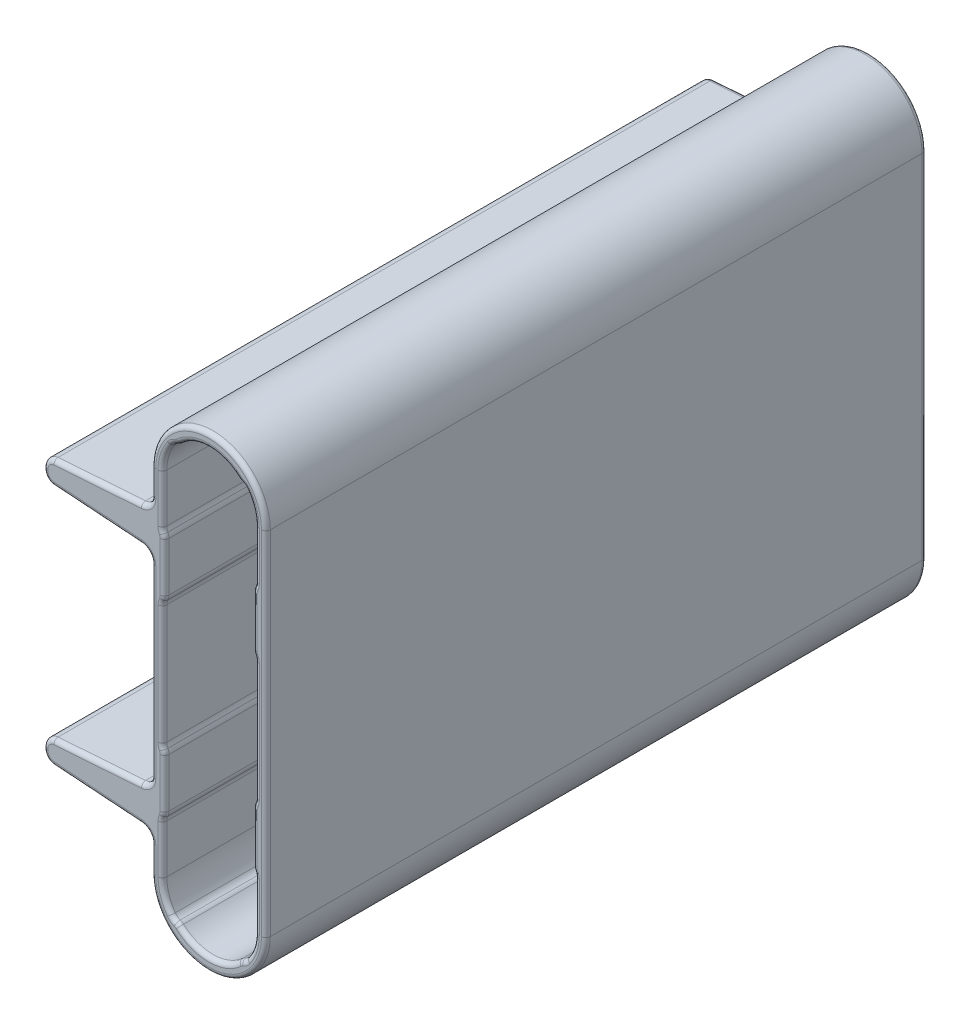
SolidWorks part; units mm, degrees
ref_plane "Front Plane" through (0, 0, 0) normal (0, 0, 1) x (1, 0, 0)
ref_plane "Top Plane" through (0, 0, 0) normal (0, 1, 0) x (1, 0, 0)
ref_plane "Right Plane" through (0, 0, 0) normal (1, 0, 0) x (0, 0, -1)
sketch "Sketch1" plane through (0, 0, 0) normal (0, 0, 1) x (1, 0, 0)
  line L0 (0, 0) -> (126.5517, 0) construction
  line L1 (0, 0) -> (65.9983, -75.128) construction
  line L2 (0, 0) -> (65.9983, 75.128) construction
  line L3 (0, 0) -> (100, 0) construction
  line L4 (0, 0) -> (0, -117.3978) construction
  line L5 (0, 80) -> (0, -80) construction
  line L6 (20, 80) -> (20, -80)
  line L7 (-20, 80) -> (-20, -80)
  line L8 (133.8609, 17.5) -> (145, 17.5)
  line L9 (133.8609, -17.5) -> (145, -17.5)
  line L10 (145, 17.5) -> (145, -17.5)
  line L11 (135, 0) -> (145, -17.5) construction
  line L12 (135, 0) -> (145, 17.5) construction
  line L13 (-145, 17.5) -> (-133.8609, 17.5)
  line L14 (-145, 17.5) -> (-145, -17.5)
  line L15 (-145, -17.5) -> (-133.8609, -17.5)
  line L16 (-145, 17.5) -> (-135, 0) construction
  line L17 (-145, -17.5) -> (-135, 0) construction
  line L18 (21, 80) -> (21, -80)
  line L19 (-21, 80) -> (-21, -80)
  line L20 (26, 80) -> (26, -80)
  line L21 (-26, 80) -> (-26, -80)
  line L22 (14.1421, -94.1421) -> (14.8492, -94.8492)
  line L23 (-14.1421, -94.1421) -> (-14.8492, -94.8492)
  line L24 (-14.1421, 94.1421) -> (-14.8492, 94.8492)
  line L25 (14.1421, 94.1421) -> (14.8492, 94.8492)
  line L26 (21, -55) -> (20, -55)
  line L27 (21, -30) -> (20, -30)
  line L28 (21, 30) -> (20, 30)
  line L29 (21, 55) -> (20, 55)
  line L30 (-21, -30) -> (-20, -30)
  line L31 (-21, -55) -> (-20, -55)
  line L32 (-21, 55) -> (-20, 55)
  line L33 (-21, 30) -> (-20, 30)
  line L34 (0, -80) -> (14.1421, -94.1421) construction
  line L35 (0, -80) -> (-14.1421, -94.1421) construction
  arc A0 (65.9983, -75.128) -> (65.9983, 75.128) centre (0, 0) ccw construction
  arc A1 (79.198, -90.1536) -> (79.198, 90.1536) centre (0, 0) ccw
  arc A2 (52.7987, -60.1024) -> (52.7987, 60.1024) centre (0, 0) ccw
  arc A3 (52.7987, -60.1024) -> (79.198, -90.1536) centre (65.9983, -75.128) ccw
  arc A4 (79.198, 90.1536) -> (52.7987, 60.1024) centre (65.9983, 75.128) ccw
  arc A5 (-65.9983, -75.128) -> (-65.9983, 75.128) centre (0, 0) cw construction
  arc A6 (-79.198, -90.1536) -> (-79.198, 90.1536) centre (0, 0) cw
  arc A7 (-52.7987, -60.1024) -> (-52.7987, 60.1024) centre (0, 0) cw
  arc A8 (-52.7987, -60.1024) -> (-79.198, -90.1536) centre (-65.9983, -75.128) cw
  arc A9 (48.8388, -55.5947) -> (83.1579, -94.6613) centre (65.9983, -75.128) ccw
  arc A10 (83.1579, -94.6613) -> (83.1579, 94.6613) centre (0, 0) ccw
  arc A11 (83.1579, 94.6613) -> (48.8388, 55.5947) centre (65.9983, 75.128) ccw
  arc A12 (48.8388, -55.5947) -> (48.8388, 55.5947) centre (0, 0) ccw
  arc A13 (52.1387, -59.3512) -> (79.858, -90.9049) centre (65.9983, -75.128) ccw
  arc A14 (52.1387, -59.3512) -> (52.1387, 59.3512) centre (0, 0) ccw
  arc A15 (79.858, 90.9049) -> (52.1387, 59.3512) centre (65.9983, 75.128) ccw
  arc A16 (79.858, -90.9049) -> (79.858, 90.9049) centre (0, 0) ccw
  arc A17 (-79.198, 90.1536) -> (-52.7987, 60.1024) centre (-65.9983, 75.128) cw
  arc A18 (20, 80) -> (-20, 80) centre (0, 80) ccw
  arc A19 (-20, -80) -> (20, -80) centre (0, -80) ccw
  circle A20 centre (65.9983, 75.128) radius 7.5
  circle A21 centre (65.9983, -75.128) radius 7.5
  circle A22 centre (0, -80) radius 7.5
  circle A23 centre (0, 80) radius 7.5
  circle A24 centre (-65.9983, 75.128) radius 7.5
  circle A25 centre (-65.9983, -75.128) radius 7.5
  circle A26 centre (0, 0) radius 135
  arc A27 (-21, -80) -> (21, -80) centre (0, -80) ccw
  arc A28 (21, 80) -> (-21, 80) centre (0, 80) ccw
  arc A29 (-26, -80) -> (26, -80) centre (0, -80) ccw
  arc A30 (26, 80) -> (-26, 80) centre (0, 80) ccw
  point P20 (100, 0)
  point P30 (-100, 0)
  point P37 (0, 0)
  point P55 (135, 0)
  point P59 (-135, 0)
  dimension "D1" = 79
  dimension "D2" = 42
  dimension "D5" = 1
  dimension "D3" = 5
  dimension "D4" = 48.701
  dimension "D7" = 25
  dimension "D8" = 30
  dimension "D6" = 5
extrude "Extrude1" add sketch "Sketch1" along normal blind 300 contours L20 A30 L21 A29 A28 L18 A27 L19 | L23 A27 L22 A19 | L19 L31 L7 L30 | L18 L27 L6 L26 | L19 L33 L7 L32 | L18 L29 L6 L28 | L25 A28 L24 A18
ref_plane "Plane4" through (-75, 0, 0) normal (1, 0, 0) x (0, 0, -1)
sketch "Sketch3" plane through (-75, 0, 0) normal (1, 0, 0) x (0, 0, -1)
  line L0 (17.1923, 0) -> (-312.4893, 0) construction
  line L2 (-300, 80) -> (-300, -80) construction
  line L3 (0, 80) -> (0, -80) construction
  line L4 (-300, -50) -> (0, -50)
  line L5 (-300, -50) -> (-300, -60)
  line L6 (-300, -60) -> (0, -60)
  line L7 (0, -50) -> (0, -60)
  dimension "D1" = 10
  dimension "D2" = 100
extrude "Extrude2" add sketch "Sketch3" along normal up to body
draft "Draft1" type of draft neutral plane draft angle 4 faces to draft 2 parameters "D1"=4
ref_plane "Plane3" through (75, 0, 0) normal (1, 0, 0) x (0, 0, -1)
mirror "Mirror1" about plane through (0, 0, 0) normal (0, 1, 0) of "Draft1", "Extrude2"
ref_plane "Plane1" through (0, 0, 50) normal (0, 0, 1) x (1, 0, 0)
sketch "Sketch4" plane through (0, 0, 50) normal (0, 0, 1) x (1, 0, 0)
  line L0 (4.6962, -45.5289) -> (4.6962, 45.5289) construction
  line L1 (-26, -19.975) -> (-26, 19.975)
  line L2 (4.6962, 0) -> (-35, 0) construction
  line L3 (-26, 46.5736) -> (-26, -46.5736) construction
  circle A1 centre (-35, 0) radius 3.75
  arc A2 (-35.5, 9.9875) -> (-35.5, -9.9875) centre (-35, 0) ccw
  arc A5 (-26, -19.975) -> (-35.5, -9.9875) centre (-36, -19.975) ccw
  arc A6 (-26, 19.975) -> (-35.5, 9.9875) centre (-36, 19.975) cw
  dimension "D2" = 7.5
  dimension "D3" = 20
  dimension "D4" = 10
  dimension "D1" = 9
extrude "Extrude3" add sketch "Sketch4" along normal blind 25
sketch "Sketch5" plane through (0, 0, 0) normal (1, 0, 0) x (0, 0, -1)
  line L0 (0, 0) -> (-40, 0) construction
  line L1 (-45, 40) -> (-40, 40)
  line L2 (-45, 40) -> (-45, -40)
  line L3 (-45, -40) -> (-40, -40)
  line L4 (-40, 40) -> (-40, -40)
  line L5 (0, 46.5736) -> (0, -46.5736) construction
  line L6 (-42.5, -40) -> (-42.5, 40) construction
  line L7 (-50, -9.9875) -> (-50, 9.9875) construction
  dimension "D1" = 5
  dimension "D2" = 5
  dimension "D3" = 80
extrude "Cut-Extrude2" cut sketch "Sketch5" against normal up to next contours L2 L3 L4 L1
pattern_linear "LPattern1" count 2 spacing 17.5 along (0, 0, -1) of "Cut-Extrude2"
fillet "Fillet9" radius 5 8 edges at (-75, 60, 150) (-75, 50, 150) (-26, 63.4264, 150) (-26, 46.5736, 150) (-75, -50, 150) (-75, -60, 150) (-26, -46.5736, 150) (-26, -63.4264, 150)
fillet "Fillet2" radius 5 16 edges at (-21, 30, 11.25) (-21, 30, 33.75) (-21, -30, 11.25) (-21, -30, 33.75) (-21, 30, 172.5) (-21, 55, 150) (-14.8492, 94.8492, 150) (14.8492, 94.8492, 150) (21, 55, 150) (21, 30, 150) (21, -30, 150) (21, -55, 150) (14.8492, -94.8492, 150) (-14.8492, -94.8492, 150) (-21, -30, 172.5) (-21, -55, 150)
fillet "Fillet3" radius 5 16 edges at (-14.1421, 94.1421, 150) (14.1421, 94.1421, 150) (20, 55, 150) (20, 30, 150) (20, -30, 150) (20, -55, 150) (14.1421, -94.1421, 150) (-14.1421, -94.1421, 150) (-20, -55, 150) (-20, -30, 172.5) (-20, -30, 33.75) (-20, -30, 11.25) (-20, 55, 150) (-20, 30, 11.25) (-20, 30, 33.75) (-20, 30, 172.5)
fillet "Fillet4" radius 2 120 edges at (26, 0, 300) (0, 106, 300) (-26, 74.0445, 300) (0, -106, 300) (-75, 55, 300) (-75, 55, 0) (-26, -74.0445, 0) (-50.5, -61.7132, 0) (-75, -55, 0) (-50.5, -48.2868, 0) (-26, 0, 0) (-50.5, 48.2868, 0) (-50.5, 61.7132, 0) (-73.6568, -58.7474, 0) (-73.6568, -51.2526, 0) (-73.6568, 51.2526, 0) (-73.6568, 58.7474, 0) (-50.5, 61.7132, 300) (-50.5, 48.2868, 300) (-26, 0, 300) (-50.5, -48.2868, 300) (-75, -55, 300) (-50.5, -61.7132, 300) (-26, -74.0445, 300) (-73.6568, -58.7474, 300) (-73.6568, -51.2526, 300) (-73.6568, 51.2526, 300) (-73.6568, 58.7474, 300) (-27.3432, 64.679, 0) (-27.3432, 64.679, 300) (-27.3432, 45.321, 300) (-27.3432, 45.321, 0) (-27.3432, -45.321, 300) (-27.3432, -45.321, 0) (-27.3432, -64.679, 0) (-27.3432, -64.679, 300) (-21, 0, 0) (-21, 0, 300) (-20.007, 86.3812, 0) (-20.007, 86.3812, 300) (21, 0, 0) (21, 0, 300) (21, -69, 0) (21, -69, 300) (20.007, -86.3812, 0) (20.007, -86.3812, 300) (-21, -69, 0) (-21, -69, 300) (-20.8734, -28.118, 0) (-20.8734, 28.118, 300) (-20.8734, 56.882, 0) (-16.1389, 93.192, 300) (16.1389, 93.192, 0) (20.8734, 56.882, 300) (20.8734, 28.118, 0) (20.8734, -28.118, 300) (20.8734, -56.882, 0) (0, -106, 0) (16.1389, -93.192, 300) (-16.1389, -93.192, 0) (-26, 74.0445, 0) (-20.8734, -56.882, 300) (0, 106, 0) (26, 0, 0) (-21, 69, 0) (0, 100, 0) (0, 100, 300) (-16.1389, 93.192, 0) (-20, 42.5, 0) (-20.8734, 28.118, 0) (-20, -42.5, 0) (-20.8734, -56.882, 0) (0, -100, 0) (16.1389, -93.192, 0) (20, -42.5, 0) (20.8734, -28.118, 0) (-20.007, -86.3812, 0) (20, 42.5, 0) (20.8734, 56.882, 0) (-20.1266, 30.2409, 0) (-20.1266, 54.7591, 0) (-20.1266, -30.2409, 0) (-20.1266, -54.7591, 0) (-14.1161, -94.3053, 0) (14.1161, -94.3053, 0) (20.1266, -54.7591, 0) (20.1266, -30.2409, 0) (20.1266, 30.2409, 0) (20.1266, 54.7591, 0) (14.1161, 94.3053, 0) (-14.1161, 94.3053, 0) (20, 42.5, 300) (20.8734, 28.118, 300) (20, -42.5, 300) (20.8734, -56.882, 300) (0, -100, 300) (-16.1389, -93.192, 300) (-20, -42.5, 300) (-20.8734, -28.118, 300) (-20, 42.5, 300) (-20.8734, 56.882, 300) (16.1389, 93.192, 300) (-20.1266, 30.2409, 300) (-20.1266, 54.7591, 300) (-20.1266, -30.2409, 300) (-20.1266, -54.7591, 300) (-14.1161, -94.3053, 300) (14.1161, -94.3053, 300) (20.1266, -54.7591, 300) (20.1266, -30.2409, 300) (20.1266, 30.2409, 300) (20.1266, 54.7591, 300) (14.1161, 94.3053, 300) (-14.1161, 94.3053, 300) (21, 69, 0) (20.007, 86.3812, 0) (20.007, 86.3812, 300) (-20.007, -86.3812, 300) (21, 69, 300) (-21, 69, 300)
fillet "Fillet5" radius 2.5 6 edges at (-28.7543, 13.083, 50) (-45, 0, 50) (-28.7543, 13.083, 75) (-45, 0, 75) (-28.7543, -13.083, 50) (-28.7543, -13.083, 75)
fillet "Fillet6" radius 2 6 edges at (-26, -15.5651, 74.4449) (-26, 15.5651, 74.4449) (-26, -15.5651, 50.5551) (-26, 15.5651, 50.5551) (-26, 0, 75) (-26, 0, 50)
ref_plane "Plane2" through (0, 0, 104) normal (0, 0, -1) x (-1, 0, 0)
sketch "Sketch8" plane through (0, 0, 104) normal (0, 0, -1) x (-1, 0, 0)
  line L0 (26, -34.8995) -> (26, 34.8995)
  line L1 (26, 48.5785) -> (26, -46.5736) construction
  line L3 (-7.5554, 0) -> (45.75, 0) construction
  line L4 (39.3952, 24.1788) -> (39.3952, -24.1788) construction
  line L6 (63.5504, 26.4026) -> (26, 34.8995)
  line L7 (26, -34.8995) -> (63.5504, -26.4026)
  line L8 (69.3952, -19.0875) -> (69.3952, 19.0875)
  circle A7 centre (45.75, 0) radius 25 construction
  circle A12 centre (39.3952, -24.1788) radius 2.5
  arc A13 (63.5504, -26.4026) -> (69.3952, -19.0875) centre (61.8952, -19.0875) ccw
  arc A14 (69.3952, 19.0875) -> (63.5504, 26.4026) centre (61.8952, 19.0875) ccw
  circle A15 centre (61.8952, -19.0875) radius 2.5
  circle A16 centre (61.8952, 19.0875) radius 2.5
  circle A17 centre (39.3952, 24.1788) radius 2.5
  dimension "D1" = 19.75
  dimension "D3" = 7.5
  dimension "D5" = 50
  dimension "D6" = 5
  dimension "D2" = 25.5
  dimension "D4" = 38.1751
  dimension "D7" = 48.3577
extrude "Extrude5" add sketch "Sketch8" along normal blind 5
fillet "Fillet7" radius 5 2 edges at (-26, 34.8995, 101.5) (-26, -34.8995, 101.5)
sketch "Sketch9" plane through (0, 0, 99) normal (0, 0, -1) x (-1, 0, 0)
  line L0 (0, 0) -> (45.75, 0) construction
  circle A1 centre (45.75, 0) radius 17.5
  circle A2 centre (35, 0) radius 3.75 construction
  circle A3 centre (35, 0) radius 3.75 construction
  circle A4 centre (45.75, 0) radius 17.5 construction
  dimension "D1" = 35
extrude "Cut-Extrude3" cut sketch "Sketch9" against normal up to next
sketch "Sketch10" plane through (0, 0, 75) normal (0, 0, 1) x (1, 0, 0)
  circle A0 centre (-35, 0) radius 6
  circle A1 centre (-35, 0) radius 3.75 construction
  circle A2 centre (-35, 0) radius 3.75
  dimension "D1" = 12
extrude "Extrude6" add sketch "Sketch10" along normal blind 4
